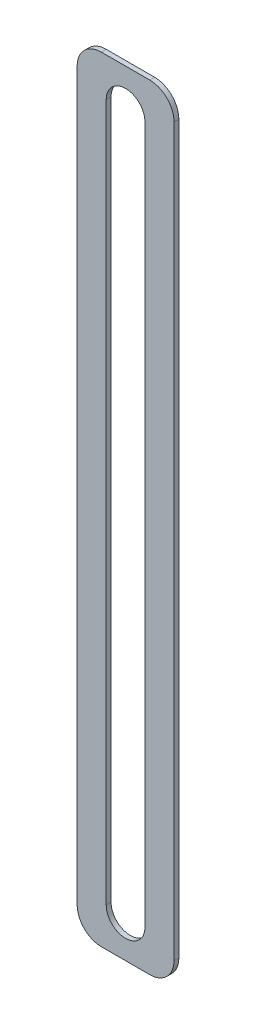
SolidWorks part; units mm, degrees
ref_plane "前基準面" through (0, 0, 0) normal (0, 0, 1) x (1, 0, 0)
ref_plane "上基準面" through (0, 0, 0) normal (0, 1, 0) x (1, 0, 0)
ref_plane "右基準面" through (0, 0, 0) normal (1, 0, 0) x (0, 0, -1)
sketch "草圖1" plane through (0, 0, 0) normal (0, 0, 1) x (1, 0, 0)
  line L0 (0, 40) -> (0, -40) construction
  line L2 (-63.5, 42.5) -> (63.5, 42.5) construction
  line L3 (-63.5, 42.5) -> (-63.5, -42.5) construction
  line L4 (-63.5, -42.5) -> (63.5, -42.5) construction
  line L5 (63.5, 42.5) -> (63.5, -42.5) construction
  line L6 (-63.5, 42.5) -> (63.5, -42.5) construction
  line L7 (-63.5, -42.5) -> (63.5, 42.5) construction
  circle A0 centre (20.5, 0) radius 2.5 construction
  circle A1 centre (10.25, -17.7535) radius 2.5 construction
  circle A2 centre (-10.25, -17.7535) radius 2.5 construction
  circle A3 centre (-20.5, 0) radius 2.5 construction
  circle A4 centre (-10.25, 17.7535) radius 2.5 construction
  circle A5 centre (10.25, 17.7535) radius 2.5 construction
  point P17 (0, 0)
  point P19 (0, 0)
  dimension "D2" = 5
  dimension "D6" = 40
  dimension "D1" = 80
  dimension "D3" = 20.5
  dimension "D5" = 17.7535
  dimension "D7" = 127
  dimension "D8" = 85
  dimension "D4" = 6
sketch "草圖2" plane through (0, 0, 0) normal (0, 0, 1) x (1, 0, 0)
  line L0 (2.5, 40) -> (-2.5, 40)
  line L1 (-5, 37.5) -> (-5, -37.5)
  line L2 (2.5, -40) -> (-2.5, -40)
  line L3 (0, 40) -> (0, -40) construction
  line L4 (0, 40) -> (0, -40) construction
  line L5 (5, 37.5) -> (5, -37.5)
  line L6 (-5, 0) -> (5, 0) construction
  line L7 (-2, -36) -> (-2, 36)
  line L8 (2, -36) -> (2, 36)
  arc A0 (-2.5, 40) -> (-5, 37.5) centre (-2.5, 37.5) ccw
  arc A1 (-5, -37.5) -> (-2.5, -40) centre (-2.5, -37.5) ccw
  arc A2 (5, -37.5) -> (2.5, -40) centre (2.5, -37.5) cw
  arc A3 (2.5, 40) -> (5, 37.5) centre (2.5, 37.5) cw
  circle A4 centre (0, 36) radius 2 construction
  arc A5 (2, 36) -> (-2, 36) centre (0, 36) ccw
  arc A6 (2, -36) -> (-2, -36) centre (0, -36) cw
  point P10 (-5, 40)
  point P13 (-5, -40)
  point P28 (-2, 0)
  point P29 (2, 0)
  dimension "D2" = 2.5
  dimension "D3" = 4
  dimension "D1" = 5
  dimension "D4" = 4
extrude "填料-伸長1" add sketch "草圖2" along normal blind 0.5 contours L7 A5 L8 A6 | L2 A1 L1 A0 L0 A3 L5 A2
